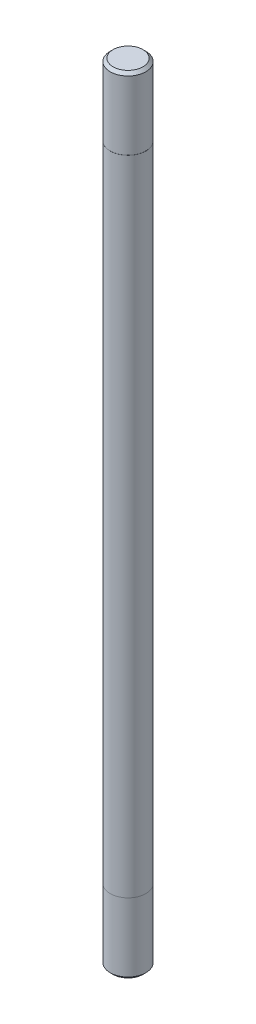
SolidWorks part; units mm, degrees
ref_plane "Front" through (0, 0, 0) normal (0, 0, 1) x (1, 0, 0)
ref_plane "Top" through (0, 0, 0) normal (0, 1, 0) x (1, 0, 0)
ref_plane "Right" through (0, 0, 0) normal (1, 0, 0) x (0, 0, -1)
sketch "Sketch1" plane through (0, 0, 0) normal (0, 1, 0) x (1, 0, 0)
  circle A0 centre (0, 0) radius 2.5
extrude "Extrude1" add sketch "Sketch1" along normal blind 90
sketch "Sketch2" plane through (0, 90, 0) normal (0, 1, 0) x (-1, 0, 0)
  circle A0 centre (0, 0) radius 2.49
extrude "Extrude2" add sketch "Sketch2" along normal blind 10
sketch "Sketch3" plane through (0, 0, 0) normal (0, -1, 0) x (1, 0, 0)
  circle A0 centre (0, 0) radius 2.49
extrude "Extrude3" add sketch "Sketch3" along normal blind 10
chamfer "Chamfer2" distance 0.4 angle 45 2 edges at (0, 100, 2.49) (0, -10, -2.49)
